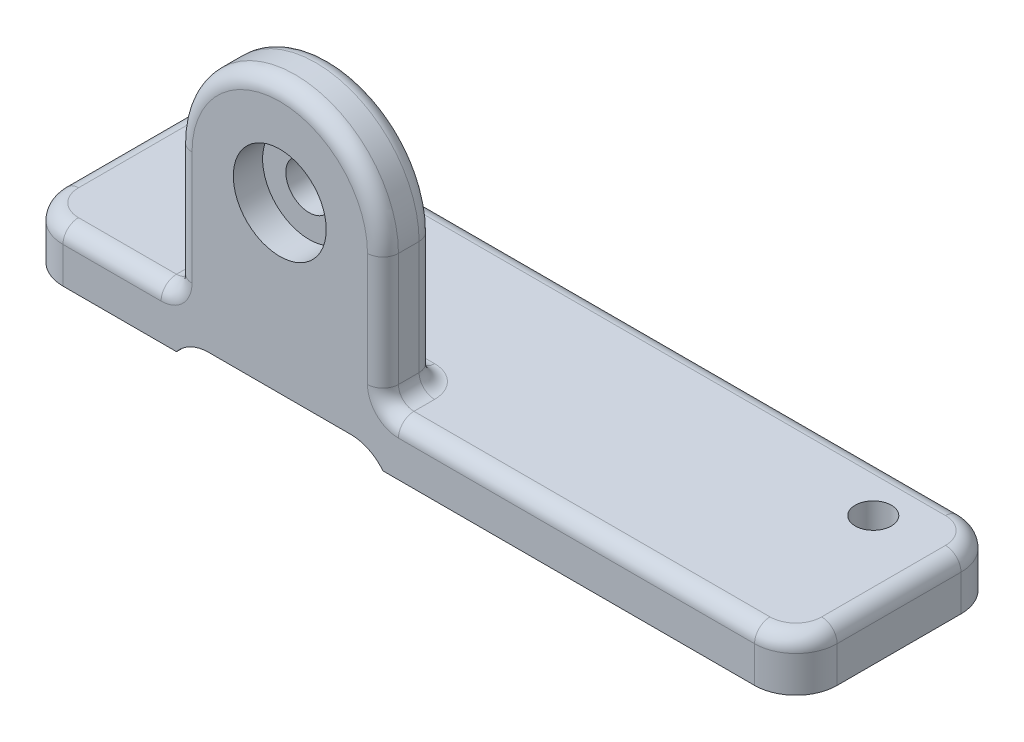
SolidWorks part; units mm, degrees
ref_plane "Front Plane" through (0, 0, 0) normal (0, 0, 1) x (1, 0, 0)
ref_plane "Top Plane" through (0, 0, 0) normal (0, 1, 0) x (1, 0, 0)
ref_plane "Right Plane" through (0, 0, 0) normal (1, 0, 0) x (0, 0, -1)
other "Configuration Table"
sketch "Sketch1" plane through (0, 0, 0) normal (0, 1, 0) x (1, 0, 0)
  line L1 (0, 0) -> (150, 0)
  line L2 (0, 0) -> (0, 40)
  line L3 (0, 40) -> (150, 40)
  line L4 (150, 0) -> (150, 40)
  dimension "D1" = 150
  dimension "D2" = 40
extrude "Base Plate" add sketch "Sketch1" along normal blind 10
sketch "Sketch2" plane through (0, 0, 0) normal (0, 0, 1) x (1, 0, 0)
  line L0 (30, 0) -> (30, 35)
  line L1 (0, 0) -> (150, 0) construction
  line L2 (70, 35) -> (70, 0)
  line L3 (70, 0) -> (30, 0)
  line L4 (0, 10) -> (0, 0) construction
  arc A0 (30, 35) -> (70, 35) centre (50, 35) cw
  dimension "D1" = 20
  dimension "D2" = 50
  dimension "D3" = 35
extrude "Vert Boss" add sketch "Sketch2" against normal blind 10
sketch "Sketch5" plane through (0, 0, 0) normal (0, 0, 1) x (1, 0, 0)
  line L0 (0, 0) -> (150, 0) construction
  line L1 (30, 0) -> (70, 0)
  line L2 (30, 0) -> (30, 3)
  line L3 (30, 3) -> (70, 3)
  line L4 (70, 0) -> (70, 3)
  line L5 (30, 35) -> (30, 10) construction
  line L6 (70, 10) -> (70, 35) construction
  dimension "D1" = 3
extrude "Slot" cut sketch "Sketch5" against normal through all
hole_wizard "Ø7.0 (7) Diameter Hole1" positions "Sketch9" profile "Sketch8" hole size "Ø7.0" standard "Ansi Metric"
sketch "Sketch9" plane through (0, 10, 0) normal (0, 1, 0) x (-1, 0, 0)
  line L0 (-150, 0) -> (-150, -40) construction
  line L1 (-150, -40) -> (0, -40) construction
  line L2 (0, -40) -> (0, 0) construction
  point P0 (-135, -30)
  point P1 (-15, -30)
  dimension "D1" = 15
  dimension "D2" = 10
  dimension "D3" = 15
sketch "Sketch8" plane through (135, 10, -30) normal (1, 0, 0) x (0, 0, 1)
  line L0 (0, 0) -> (0, 10)
  line L1 (0, 10) -> (3.5, 10)
  line L2 (3.5, 10) -> (3.5, 0)
  line L5 (3.5, 0) -> (0, 0)
  line L11 (0, -6.35) -> (0, 107.95) construction
  dimension "Thru Hole Dia." = 7
  dimension "Thru Hole Depth" = 10
hole_wizard "CBORE for M8 Hex Head Bolt1" positions "Sketch4" profile "Sketch3" counterbore size "M8" standard "Ansi Metric"
sketch "Sketch4" plane through (0, 0, 0) normal (0, 0, 1) x (1, 0, 0)
  point P0 (50, 35)
sketch "Sketch3" plane through (50, 35, 0) normal (1, 0, 0) x (0, -1, 0)
  line L0 (0, 0) -> (0, 40)
  line L1 (0, 40) -> (4.5, 40)
  line L3 (4.5, 40) -> (4.5, 5.68)
  line L4 (4.5, 5.68) -> (9.005, 5.68)
  line L5 (9.005, 5.68) -> (9.005, 0)
  line L7 (9.005, 0) -> (0, 0)
  line L11 (0, -6.35) -> (0, 107.95) construction
  dimension "Thru Hole Dia." = 9
  dimension "Thru Hole Depth" = 40
  dimension "C'Bore Dia." = 18.01
  dimension "C'Bore Depth" = 5.68
fillet "Fillet1" radius 8 6 edges at (70, 3, -20) (30, 3, -20) (0, 5, 0) (0, 5, -40) (150, 5, -40) (150, 5, 0)
fillet "Fillet2" radius 3 18 edges at (2.3431, 10, -37.6569) (0, 10, -20) (75, 10, -40) (2.3431, 10, -2.3431) (147.6569, 10, -37.6569) (19, 10, 0) (150, 10, -20) (30, 10, -5) (147.6569, 10, -2.3431) (50, 10, -10) (106, 10, 0) (70, 22.5, -10) (30, 22.5, -10) (70, 22.5, 0) (30, 22.5, 0) (70, 10, -5) (50, 55, -10) (50, 55, 0)
